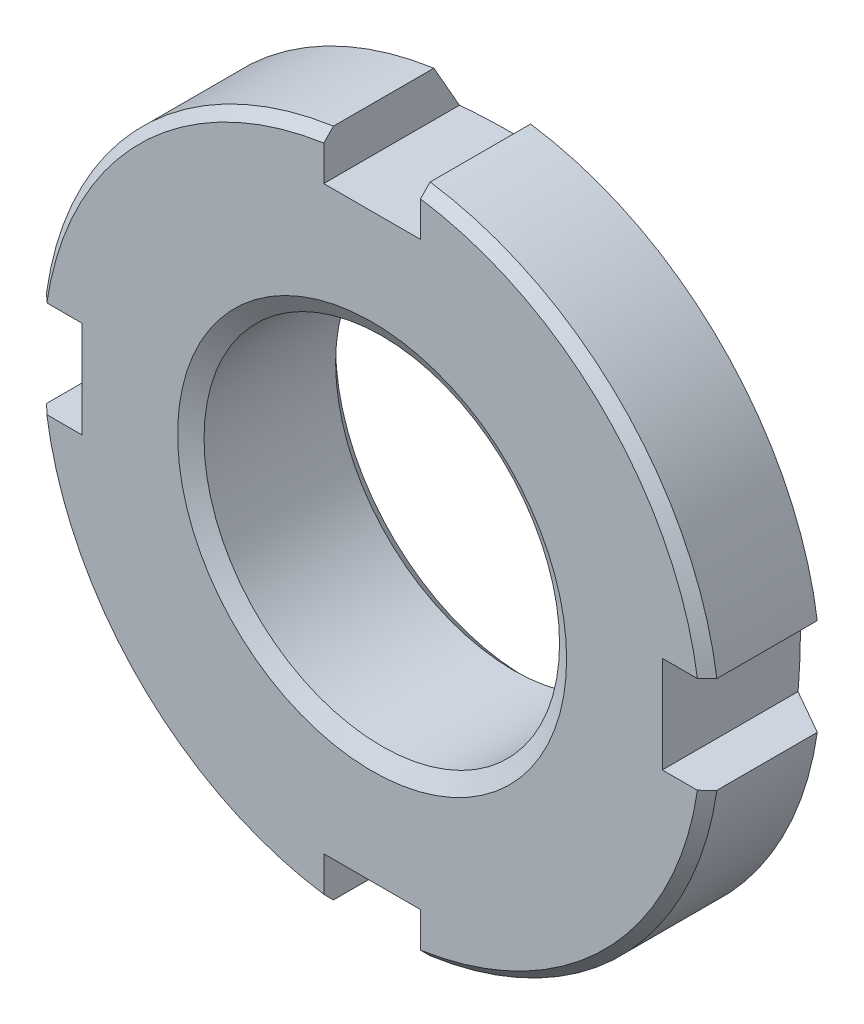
SolidWorks part; units mm, degrees
ref_plane "Front" through (0, 0, 0) normal (0, 0, 1) x (1, 0, 0)
ref_plane "Top" through (0, 0, 0) normal (0, 1, 0) x (1, 0, 0)
ref_plane "Right" through (0, 0, 0) normal (1, 0, 0) x (0, 0, -1)
sketch "Sketch1" plane through (0, 0, 0) normal (0, 0, 1) x (1, 0, 0)
  circle A0 centre (0, 0) radius 17.5
  circle A1 centre (0, 0) radius 9.188
  dimension "dk" = 35
  dimension "D" = 18.376
extrude "BaseNut" add sketch "Sketch1" against normal blind 8
sketch "Sketch2" plane through (0, 0, 0) normal (0, 1, 0) x (1, 0, 0)
  line L0 (-17.5, 8) -> (-13.5, 8)
  line L2 (-13.5, 8) -> (-17.5, 5.6906)
  line L3 (-17.5, 5.6906) -> (-17.5, 8)
  line L4 (0, 4.5605) -> (0, -11.63) construction
  line L7 (17.5, 8) -> (-17.5, 8) construction
  line L8 (-17.5, 8) -> (-17.5, 0) construction
  dimension "d1" = 27
  dimension "Angle" = 30
revolve "StepCut" cut sketch "Sketch2" angle 360 about L4
chamfer "Chamfer1" distance 0.5 angle 45 1 edges at (17.5, 0, 0)
chamfer "EndChamfer" distance 0.5 angle 60 1 edges at (9.188, 0, 0)
chamfer "Chamfer2" distance 0.7 angle 45 1 edges at (9.188, 0, -8)
sketch "Sketch3" plane through (-3.5543, 4.131, -8) normal (0, 0, -1) x (-1, 0, 0)
  line L0 (-6.0543, -19.131) -> (-1.0543, -19.131)
  line L1 (-1.0543, -19.131) -> (-1.0543, -21.4515)
  line L3 (-6.0543, -21.4515) -> (-6.0543, -19.131)
  circle A0 centre (-3.5543, -4.131) radius 17.5 construction
  arc A1 (-6.0543, -21.4515) -> (-1.0543, -21.4515) centre (-3.5543, -4.131) ccw
  dimension "n1" = 2.5
  dimension "n" = 5
  dimension "t" = 2.5
extrude "SlotCut" cut sketch "Sketch3" against normal through all
pattern_circular "SlotPat" count 4 over 360 about axis through (0, 0, -4.5605) along (0, 0, 1) of "SlotCut"
sketch "Sketch4" plane through (0, 0, 0) normal (1, 0, 0) x (0, 0, -1)
  line L0 (16.8557, 0) -> (-7.8489, 0) construction
  line L1 (6.894, 8.376) -> (7.706, 8.376)
  line L2 (7.706, 8.376) -> (7.706, 9.188)
  line L3 (7.706, 9.188) -> (7.3, 9.8912)
  line L4 (7.3, 9.8912) -> (6.894, 9.188)
  line L5 (6.894, 9.188) -> (6.894, 8.376)
  line L6 (7.3, -9.188) -> (7.3, 9.188) construction
  dimension "D1" = 0.812
  dimension "D2" = 18.376
revolve "Cut-Revolve10" [suppressed] cut sketch "Sketch4" angle 360 about L0
pattern_linear "LPattern10" [suppressed] count 8 spacing 0.9744 along (0, 0, 1)
equation "\"n1@Sketch3\" = \"n@Sketch3\" / 2"
equation "\"D1@Chamfer2\" = \"C1@EndChamfer\" * 1.4"
equation "\"D1@Sketch4\" = (  \"D2@ThreadCosmetic1\" - \"D@Sketch1\" )  / 2"
equation "\"D2@Sketch4\" = \"D@Sketch1\""
equation "\"D3@LPattern10\" = \"D1@Sketch4\" * 1.2"
equation "\"D1@LPattern10\" = \"m@BaseNut\" / \"D3@LPattern10\""
